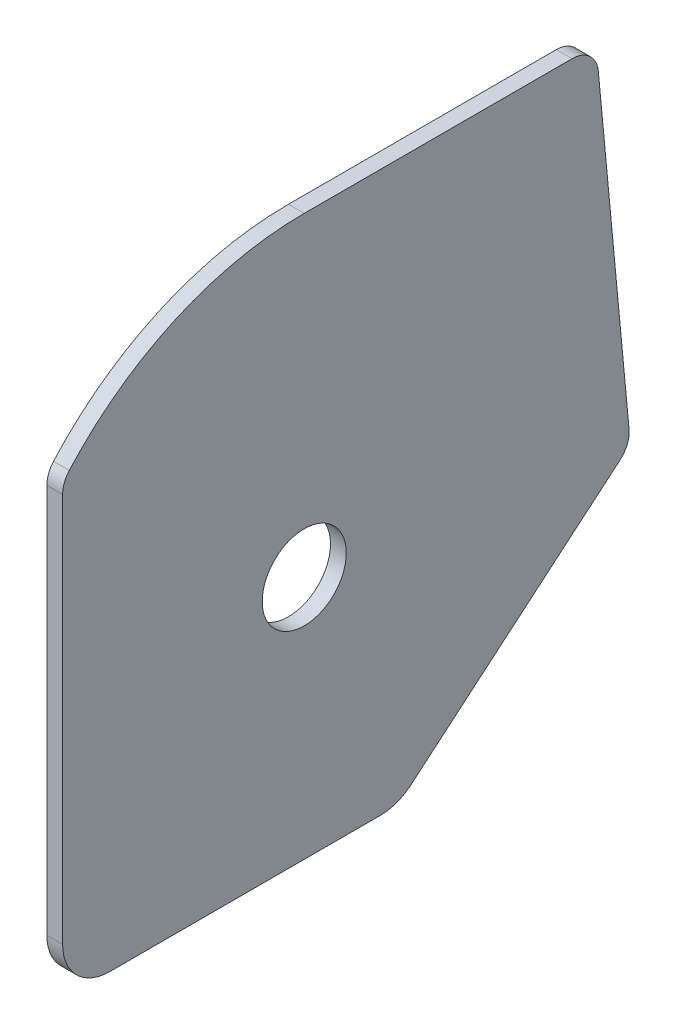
SolidWorks part; units mm, degrees
ref_plane "Plan de face" through (0, 0, 0) normal (0, 0, 1) x (1, 0, 0)
ref_plane "Plan de dessus" through (0, 0, 0) normal (0, 1, 0) x (1, 0, 0)
ref_plane "Plan de droite" through (0, 0, 0) normal (1, 0, 0) x (0, 0, -1)
sketch "Esquisse1" plane through (0, 0, 0) normal (1, 0, 0) x (0, 0, -1)
  line L0 (-46, 36.6606) -> (-46, -37.5)
  line L1 (-37, -46.5) -> (14.5, -46.5)
  line L2 (20.3091, -44.3742) -> (60.0827, -10.7629)
  line L3 (61.8332, -6.4734) -> (55.9778, 55.4705)
  line L4 (51, 60) -> (0, 60)
  circle A0 centre (0, 0) radius 8
  arc A1 (0, 60) -> (-44.7273, 39.9934) centre (0, 0) ccw
  arc A2 (55.9778, 55.4705) -> (51, 60) centre (51, 55) ccw
  arc A3 (60.0827, -10.7629) -> (61.8332, -6.4734) centre (56.8554, -6.9439) ccw
  arc A4 (-44.7273, 39.9934) -> (-46, 36.6606) centre (-41, 36.6606) ccw
  arc A5 (-37, -46.5) -> (-46, -37.5) centre (-37, -37.5) cw
  arc A6 (20.3091, -44.3742) -> (14.5, -46.5) centre (14.5, -37.5) cw
  dimension "D4" = 16
  dimension "D5" = 60
  dimension "D8" = 5
  dimension "D9" = 9
  dimension "D1" = 46
  dimension "D2" = 46.5
  dimension "D3" = 60
  dimension "D6" = 95.4
  dimension "D7" = 139.8
  dimension "D10" = 51
  dimension "D11" = 51.5
extrude "Extrusion1" add sketch "Esquisse1" along normal blind 3
